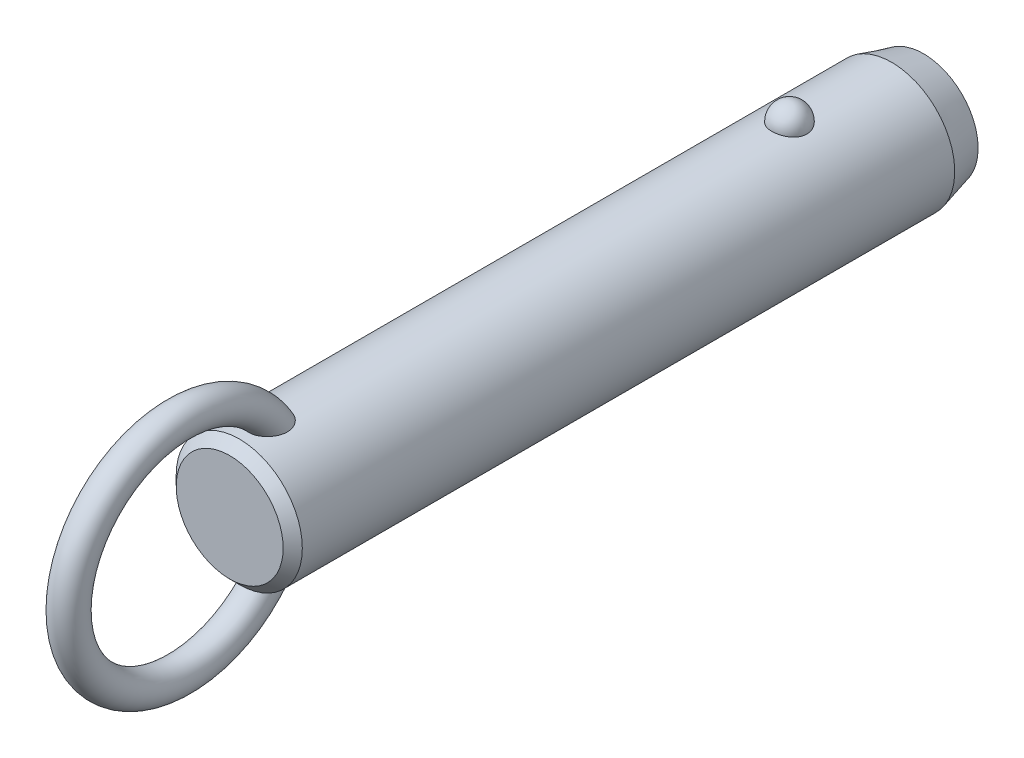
SolidWorks part; units mm, degrees
ref_plane "Front Plane" through (0, 0, 0) normal (0, 0, 1) x (1, 0, 0)
ref_plane "Top Plane" through (0, 0, 0) normal (0, 1, 0) x (1, 0, 0)
ref_plane "Right Plane" through (0, 0, 0) normal (1, 0, 0) x (0, 0, -1)
sketch "Sketch2" plane through (0, 0, 0) normal (0, 0, 1) x (1, 0, 0)
  circle A0 centre (0, 0) radius 7.9
  point P3 (0, 7.9)
  dimension "D1" = 15.8
extrude "Boss-Extrude1" add sketch "Sketch2" along normal blind 58.4
sketch "Sketch3" plane through (0, 0, 0) normal (0, 0, -1) x (-1, 0, 0)
  circle A0 centre (0, 0) radius 7.9
  dimension "D1" = 15.8
extrude "Boss-Extrude2" add sketch "Sketch3" along normal blind 19
chamfer "Chamfer1" distance 4 angle 15 1 edges at (-7.9, 0, -19)
sketch "Sketch12" plane through (0, 0, 0) normal (1, 0, 0) x (0, 0, -1)
  line L0 (-58.4, 7.9) -> (-58.4, -7.9) construction
  point P0 (-58.4, 0)
sketch "Sketch13" plane through (0, 0, 0) normal (1, 0, 0) x (0, 0, -1)
  circle A0 centre (-74.25, 0) radius 15.85
  point P2 (-58.4, 0)
  dimension "D1" = 31.7
sketch "Sketch14" plane through (0, 0, 0) normal (0, 1, 0) x (1, 0, 0)
  circle A0 centre (0, -60.4) radius 2
  point P2 (0, -58.4)
  dimension "D1" = 4
sweep "Sweep1" add profiles "Sketch14" path "Sketch13"
sketch "Sketch15" plane through (0, 0, 58.4) normal (0, 0, 1) x (1, 0, 0)
  circle A0 centre (0, 0) radius 7.9
  dimension "D1" = 15.8
extrude "Boss-Extrude3" add sketch "Sketch15" along normal blind 9.52
chamfer "Chamfer2" distance 1.2 angle 45 1 edges at (7.9, 0, 67.92)
sketch "Sketch18" plane through (0, 0, 0) normal (1, 0, 0) x (0, 0, -1)
  line L0 (15, 7.9) -> (-60.5091, 7.9) construction
  line L1 (2.2, 10.1) -> (2.2, 5.7)
  line L2 (-60.5091, -7.9) -> (15, -7.9) construction
  arc A0 (2.2, 10.1) -> (2.2, 5.7) centre (2.2, 7.9) ccw
  point P4 (0, 7.9)
  dimension "D1" = 18
revolve "Revolve1" add sketch "Sketch18" angle 360 about L1
